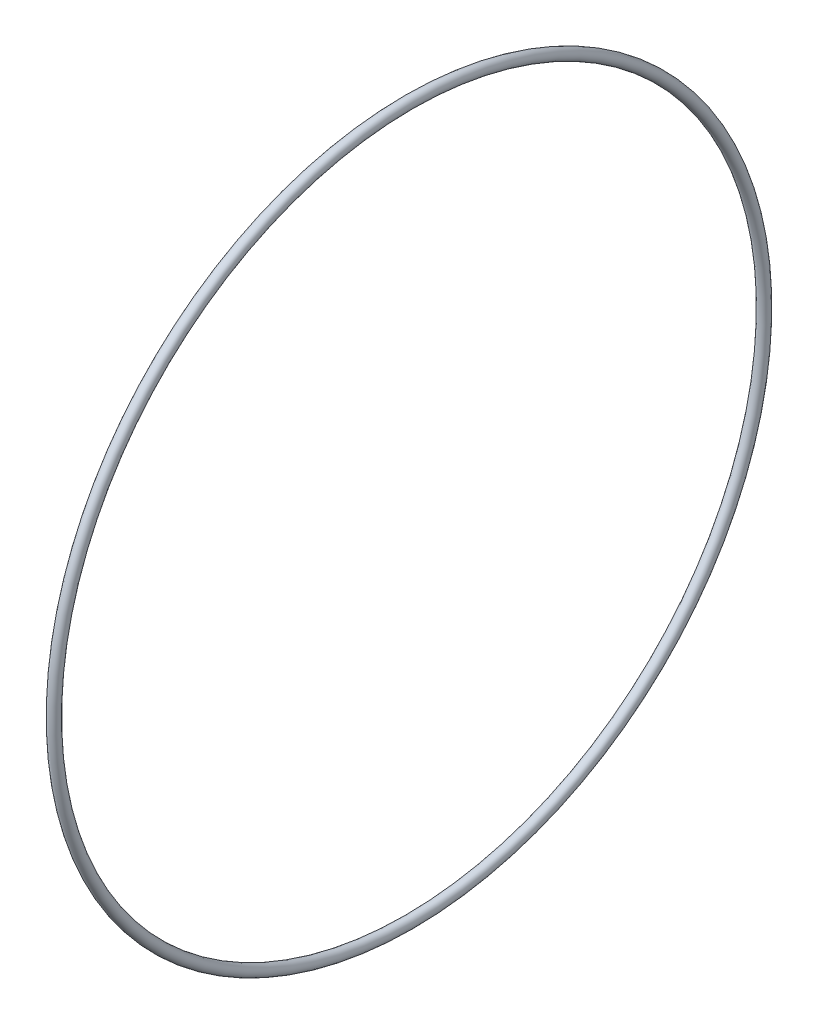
SolidWorks part; units mm, degrees
ref_plane "Plane1" through (0, 0, 0) normal (0, 0, 1) x (1, 0, 0)
ref_plane "Plane2" through (0, 0, 0) normal (0, 1, 0) x (1, 0, 0)
ref_plane "Plane3" through (0, 0, 0) normal (1, 0, 0) x (0, 0, -1)
sketch "Sketch1" plane through (0, 0, 0) normal (0, 0, 1) x (1, 0, 0)
  line L2 (0, 0) -> (19.2092, 0) construction
  circle A0 centre (0, 57.8993) radius 0.889
  dimension "D1" = 1.778
  dimension "D2" = 114.0206
revolve "Base-Revolve" add sketch "Sketch1" angle 360 about L2
